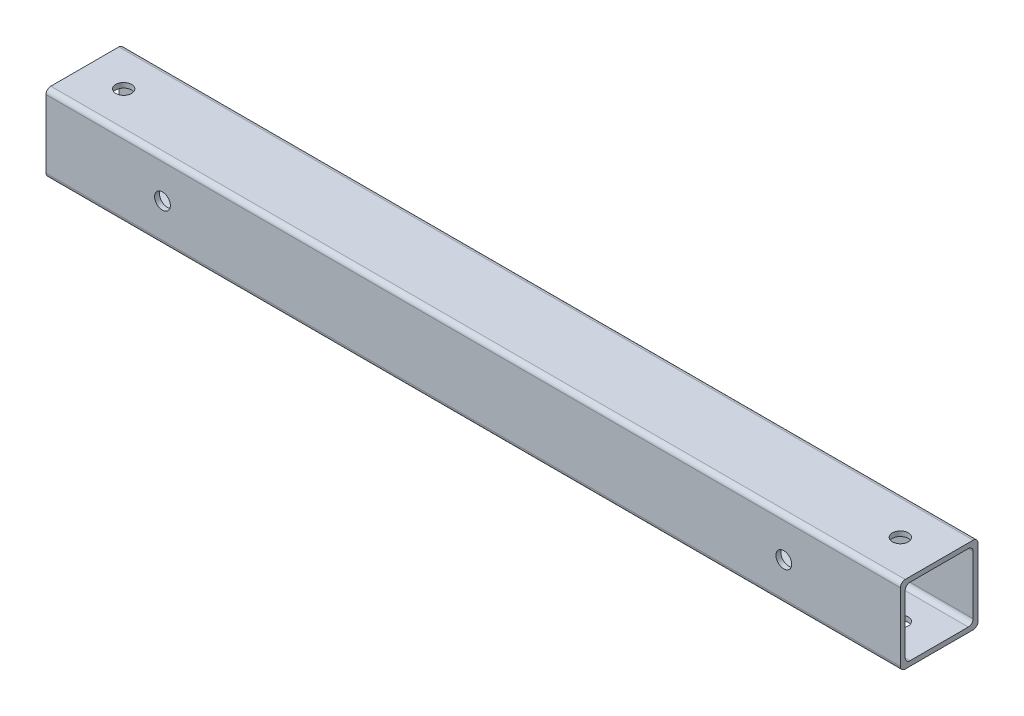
SolidWorks part; units mm, degrees
ref_plane "Front Plane" through (0, 0, 0) normal (0, 0, 1) x (1, 0, 0)
ref_plane "Top Plane" through (0, 0, 0) normal (0, 1, 0) x (1, 0, 0)
ref_plane "Right Plane" through (0, 0, 0) normal (1, 0, 0) x (0, 0, -1)
sketch "Sketch1" plane through (0, 0, 0) normal (0, 1, 0) x (1, 0, 0)
  line L1 (0, 0) -> (-1117.6, 0)
  line L2 (0, 0) -> (0, -101.6)
  line L3 (0, -101.6) -> (-1117.6, -101.6)
  line L4 (-1117.6, 0) -> (-1117.6, -101.6)
  dimension "D1" = 1117.6
  dimension "D2" = 101.6
extrude "Extrude1" add sketch "Sketch1" along normal blind 101.6
sketch "Sketch2" plane through (-1117.6, 0, 0) normal (-1, 0, 0) x (0, 0, 1)
  line L0 (0, 101.6) -> (101.6, 101.6) construction
  line L1 (6.35, 95.25) -> (95.25, 95.25)
  line L2 (6.35, 95.25) -> (6.35, 6.35)
  line L3 (6.35, 6.35) -> (95.25, 6.35)
  line L4 (95.25, 95.25) -> (95.25, 6.35)
  line L5 (0, 0) -> (101.6, 0) construction
  line L6 (101.6, 101.6) -> (101.6, 0) construction
  line L7 (0, 101.6) -> (0, 0) construction
  dimension "D1" = 6.35
  dimension "D2" = 6.35
  dimension "D3" = 6.35
  dimension "D4" = 6.35
extrude "Cut-Extrude1" cut sketch "Sketch2" against normal up to next
fillet "Fillet1" radius 6.35 8 edges at (-558.8, 6.35, 95.25) (-558.8, 0, 101.6) (-558.8, 101.6, 101.6) (-558.8, 95.25, 95.25) (-558.8, 95.25, 6.35) (-558.8, 101.6, 0) (-558.8, 6.35, 6.35) (-558.8, 0, 0)
sketch "Sketch3" plane through (0, 101.6, 0) normal (0, 1, 0) x (1, 0, 0)
  line L0 (0, -95.25) -> (0, -6.35) construction
  line L1 (0, -6.35) -> (-1117.6, -6.35) construction
  circle A0 centre (-1066.8, -50.8) radius 10.3188
  dimension "D1" = 20.6375
  dimension "D2" = 1066.8
  dimension "D3" = 44.45
extrude "Cut-Extrude2" cut sketch "Sketch3" against normal blind 101.6
sketch "Sketch4" plane through (0, 0, 101.6) normal (0, 0, 1) x (1, 0, 0)
  line L0 (0, 95.25) -> (0, 6.35) construction
  line L1 (0, 95.25) -> (-1117.6, 95.25) construction
  circle A0 centre (-965.2, 50.8) radius 10.3188
  dimension "D1" = 20.6375
  dimension "D2" = 965.2
  dimension "D3" = 44.45
extrude "Cut-Extrude3" cut sketch "Sketch4" against normal blind 101.6
ref_plane "Plane1" through (-558.8, 0, 0) normal (1, 0, 0) x (0, 0, -1)
mirror "Mirror1" about plane through (-558.8, 0, 0) normal (1, 0, 0) of "Cut-Extrude3", "Cut-Extrude2"
